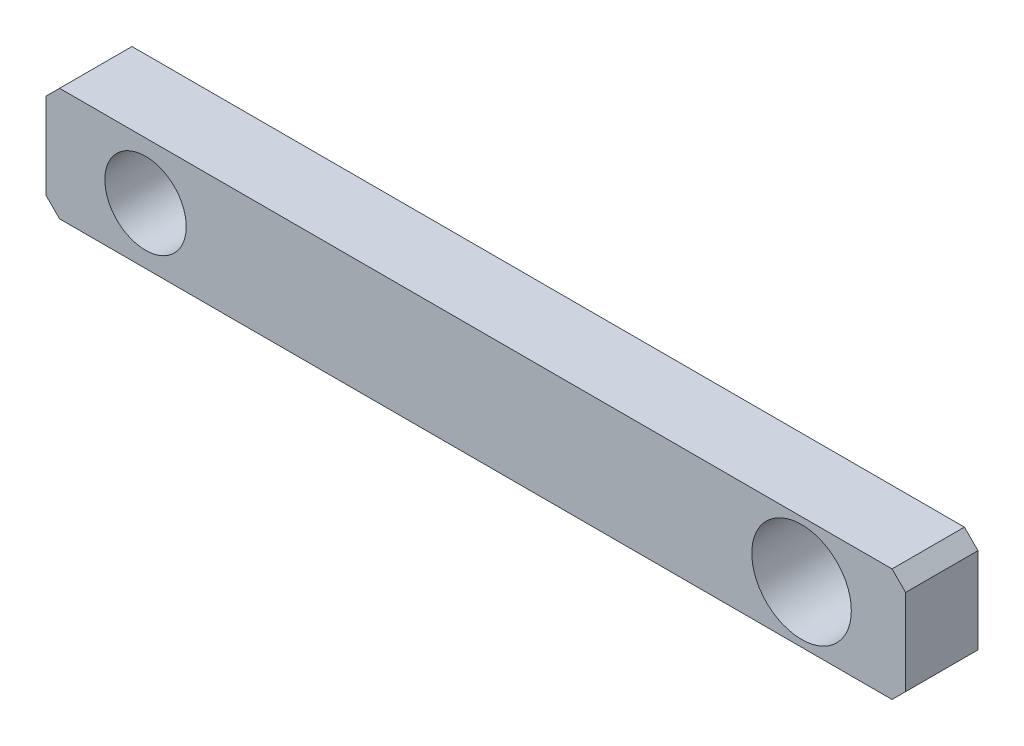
SolidWorks part; units mm, degrees
ref_plane "Face" through (0, 0, 0) normal (0, 0, 1) x (1, 0, 0)
ref_plane "Dessus" through (0, 0, 0) normal (0, 1, 0) x (1, 0, 0)
ref_plane "Droite" through (0, 0, 0) normal (1, 0, 0) x (0, 0, -1)
sketch "Esquisse1" plane through (0, 0, 0) normal (0, 0, 1) x (1, 0, 0)
  line L1 (-150.528, 3.1708) -> (39.472, 3.1708)
  line L2 (-150.528, 3.1708) -> (-150.528, -21.8292)
  line L3 (-150.528, -21.8292) -> (39.472, -21.8292)
  line L4 (39.472, 3.1708) -> (39.472, -21.8292)
  dimension "D1" = 25
  dimension "D2" = 190
extrude "Base-Extrusion" add sketch "Esquisse1" along normal blind 16
chamfer "Chanfrein1" distance 3 angle 45
sketch "Esquisse2" plane through (0, 0, 16) normal (0, 0, 1) x (1, 0, 0)
  line L0 (-147.528, -21.8292) -> (36.472, -21.8292) construction
  line L1 (-150.528, 0.1708) -> (-150.528, -18.8292) construction
  circle A0 centre (-128.528, -9.3292) radius 9
  circle A1 centre (16.472, -9.3292) radius 11
  dimension "D3" = 18
  dimension "D4" = 22
  dimension "D5" = 22
  dimension "D6" = 145
  dimension "D1" = 12.5
  dimension "D2" = 12.5
extrude "Enlèv. mat.-Extru.1" cut sketch "Esquisse2" against normal blind 30
ref_plane "Plan1" through (0, 0, 8) normal (0, 0, 1) x (1, 0, 0)
